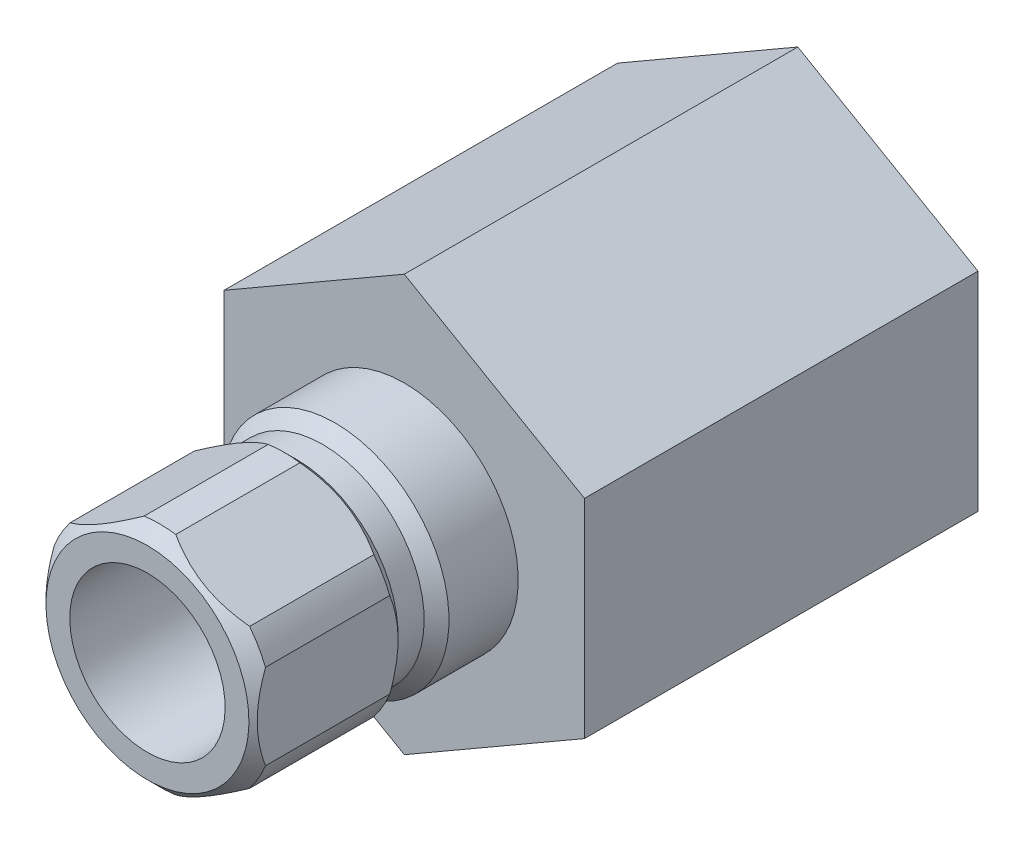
SolidWorks part; units mm, degrees
ref_plane "Front Plane" through (0, 0, 0) normal (0, 0, 1) x (1, 0, 0)
ref_plane "Top Plane" through (0, 0, 0) normal (0, 1, 0) x (1, 0, 0)
ref_plane "Right Plane" through (0, 0, 0) normal (1, 0, 0) x (0, 0, -1)
sketch "Sketch1" plane through (0, 0, 0) normal (1, 0, 0) x (0, 0, -1)
  line L0 (0, 0) -> (-18.923, 0) construction
  line L1 (-15.748, 4.7625) -> (-15.748, 6.223)
  line L2 (-6.604, 6.223) -> (-6.604, 0) construction
  line L3 (-14.986, 6.985) -> (-7.366, 6.985)
  line L4 (0, 13.208) -> (0, 0) construction
  line L5 (-6.604, 6.223) -> (-5.0038, 6.223)
  line L6 (-4.2418, 6.985) -> (0, 6.985)
  line L7 (0, 6.985) -> (0, 13.208)
  line L8 (-6.604, 6.223) -> (-7.366, 6.985)
  line L9 (-5.0038, 6.223) -> (-4.2418, 6.985)
  line L10 (-15.748, 6.223) -> (-14.986, 6.985)
  line L11 (-15.748, 4.7625) -> (8.9789, 4.7625)
  line L12 (0, 13.208) -> (24.13, 13.208)
  line L13 (8.9789, 4.7625) -> (8.9789, 8.9294)
  line L14 (24.13, 13.208) -> (24.13, 9.4028)
  line L15 (8.9789, 8.9294) -> (24.13, 9.4028)
  dimension "D1" = 15.748
  dimension "D2" = 1.6002
  dimension "D3" = 0.762
  dimension "D4" = 45
  dimension "D5" = 9.144
  dimension "D6" = 45
  dimension "D7" = 1.79
  dimension "D8" = 17.8587
  dimension "D9" = 39.878
  dimension "D10" = 3.175
  dimension "D11" = 9.525
  dimension "D12" = 15.1511
  dimension "D13" = 26.416
  dimension "D14" = 13.97
revolve "Revolve1" add sketch "Sketch1" angle 360 about L0
sketch "Sketch2" plane through (0, 0, 0) normal (0, 0, 1) x (1, 0, 0)
  line L1 (-11.049, 6.3791) -> (-11.049, -6.3791)
  line L2 (-11.049, -6.3791) -> (0, -12.7583)
  line L3 (0, -12.7583) -> (11.049, -6.3791)
  line L4 (11.049, -6.3791) -> (11.049, 6.3791)
  line L5 (11.049, 6.3791) -> (0, 12.7583)
  line L6 (0, 12.7583) -> (-11.049, 6.3791)
  circle A0 centre (0, 0) radius 11.049 construction
  dimension "D1" = 22.098
extrude "Cut-Extrude1" cut sketch "Sketch2" against normal through all flip side to cut
sketch "Sketch3" plane through (0, 0, 0) normal (0, 0, 1) x (1, 0, 0)
  line L1 (-6.477, 3.7395) -> (-6.477, -3.7395)
  line L2 (-6.477, -3.7395) -> (0, -7.479)
  line L3 (0, -7.479) -> (6.477, -3.7395)
  line L4 (6.477, -3.7395) -> (6.477, 3.7395)
  line L5 (6.477, 3.7395) -> (0, 7.479)
  line L6 (0, 7.479) -> (-6.477, 3.7395)
  circle A0 centre (0, 0) radius 6.477 construction
  dimension "D1" = 12.954
extrude "Cut-Extrude2" cut sketch "Sketch3" along normal through all from vertex at 6.604 flip side to cut
